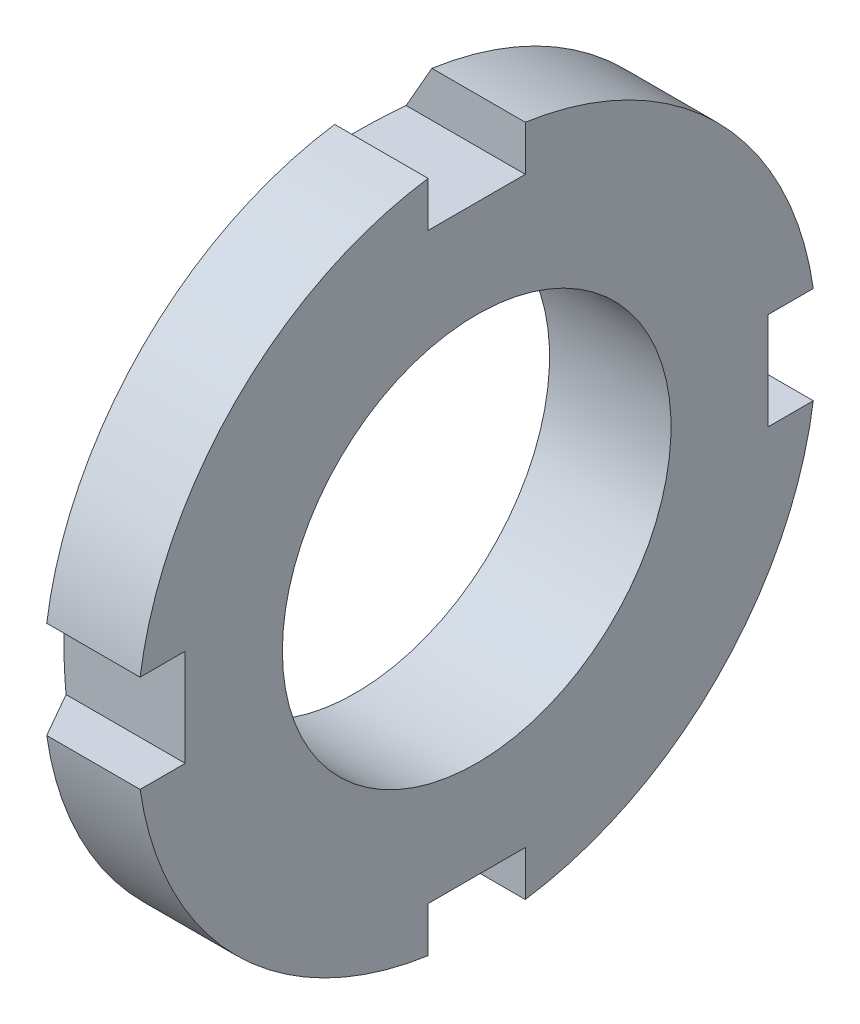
SolidWorks part; units mm, degrees
ref_plane "Face" through (0, 0, 0) normal (0, 0, 1) x (1, 0, 0)
ref_plane "Dessus" through (0, 0, 0) normal (0, 1, 0) x (1, 0, 0)
ref_plane "Droite" through (0, 0, 0) normal (1, 0, 0) x (0, 0, -1)
sketch "Esquisse1" plane through (0, 0, 0) normal (0, 0, 1) x (1, 0, 0)
  line L0 (0, 0) -> (0, 12)
  line L1 (0, 12) -> (1.1547, 14)
  line L2 (1.1547, 14) -> (5, 14)
  line L3 (5, 14) -> (5, 0)
  line L4 (0, 0) -> (6.6847, 0) construction
  line L5 (0, 0) -> (5, 0)
  dimension "D2" = 28
  dimension "D3" = 30
  dimension "D4" = 24
  dimension "D5" = 5
revolve "Révolution1" add sketch "Esquisse1" angle 360 about L4
hole_wizard "Trou taraudé M18x1.51" positions "Esquisse3" profile "Esquisse2" tap size "M18x1.5" standard "BSI"
sketch "Esquisse3" plane through (0, 0, 0) normal (-1, 0, 0) x (0, 0, 1)
  point P0 (0, 0)
sketch "Esquisse2" plane through (0, 0, 0) normal (0, 1, 0) x (0, 0, 1)
  line L0 (0, 0) -> (0, 45.1188)
  line L1 (0, 45.1188) -> (8, 40.5)
  line L2 (8, 40.5) -> (8, 0)
  line L5 (8, 0) -> (0, 0)
  line L10 (0, 45.1188) -> (-8, 40.5) construction
  line L11 (0, -6.35) -> (0, 107.95) construction
  dimension "Diamètre du trou pour taraudage" = 16
  dimension "Profondeur du trou pour taraudage" = 40.5
  dimension "Angle de pointe" = 120
sketch "Esquisse4" plane through (5, 0, 0) normal (1, 0, 0) x (0, 0, -1)
  line L1 (-2, 16.9179) -> (2, 16.9179)
  line L2 (-2, 16.9179) -> (-2, 12)
  line L3 (-2, 12) -> (2, 12)
  line L4 (2, 16.9179) -> (2, 12)
  circle A0 centre (0, 0) radius 14 construction
  dimension "D1" = 2
  dimension "D2" = 4
  dimension "D3" = 2
extrude "Enlèv. mat.-Extru.1" cut sketch "Esquisse4" against normal blind 10
pattern_circular "Répétition circulaire1" count 4 every 90 about axis through (0, 0, 0) along (1, 0, 0) of "Enlèv. mat.-Extru.1"
